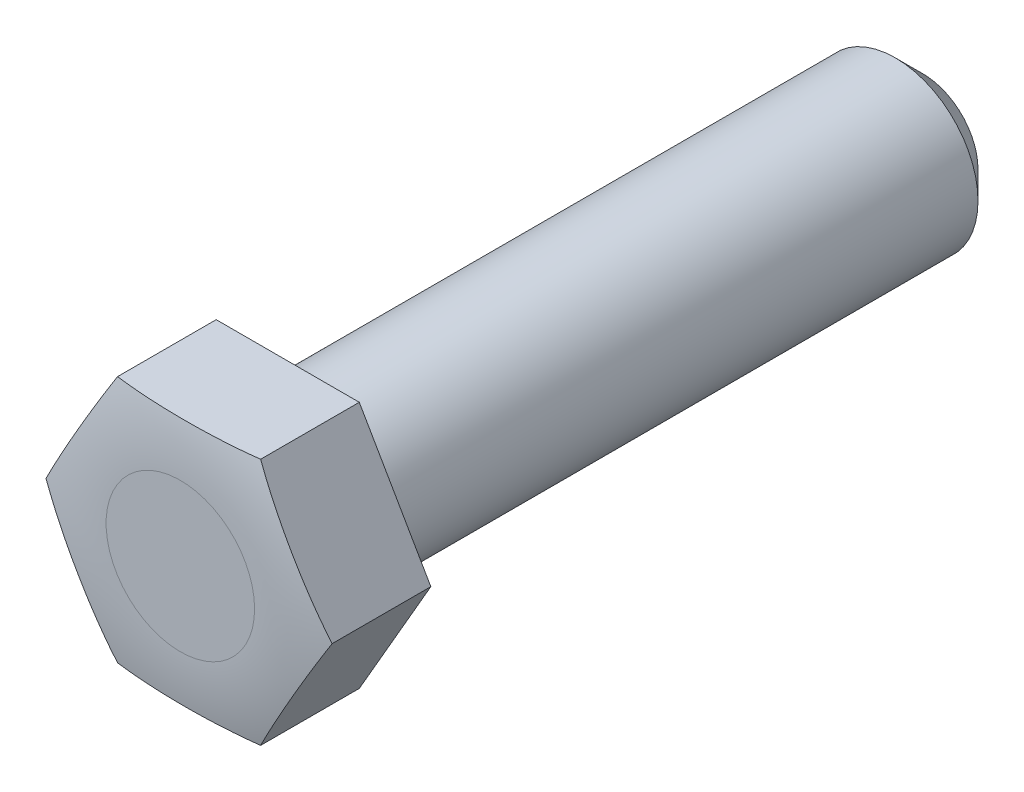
SolidWorks part; units mm, degrees
ref_plane "Plan de face" through (0, 0, 0) normal (0, 0, 1) x (1, 0, 0)
ref_plane "Plan de dessus" through (0, 0, 0) normal (0, 1, 0) x (1, 0, 0)
ref_plane "Plan de droite" through (0, 0, 0) normal (1, 0, 0) x (0, 0, -1)
sketch "Esquisse1" plane through (0, 0, 0) normal (0, 0, 1) x (1, 0, 0)
  circle A0 centre (-67, 70) radius 6
  dimension "D1" = 12
extrude "Extrusion1" add sketch "Esquisse1" against normal blind 28.2321 and the other way blind 25.7
sketch "Esquisse2" plane through (0, 0, 25.7) normal (0, 0, 1) x (1, 0, 0)
  line L1 (-56.6077, 70) -> (-61.8038, 79)
  line L2 (-61.8038, 79) -> (-72.1962, 79)
  line L3 (-72.1962, 79) -> (-77.3923, 70)
  line L4 (-77.3923, 70) -> (-72.1962, 61)
  line L5 (-72.1962, 61) -> (-61.8038, 61)
  line L6 (-61.8038, 61) -> (-56.6077, 70)
  circle A0 centre (-67, 70) radius 9 construction
  dimension "D1" = 18
extrude "Extrusion2" add sketch "Esquisse2" against normal blind 7.8
ref_plane "Plan4" through (-19.9391, -11.5119, 0) normal (-0.866, -0.5, 0) x (0, 0, -1)
sketch "Esquisse3" plane through (-19.9391, -11.5119, 0) normal (-0.866, -0.5, 0) x (0, 0, -1)
  line L0 (-17.9, -94.1218) -> (-6.7394, -94.1218) construction
  line L3 (-25.7, -88.7295) -> (-34.5241, -88.7295)
  line L4 (-25.7, -83.7295) -> (-25.0649, -83.7295)
  line L5 (-34.5241, -88.7295) -> (-34.5241, -83.7295)
  line L6 (-34.5241, -83.7295) -> (-25.7, -83.7295)
  line L9 (-25.7, -99.3179) -> (-25.7, -88.9256) construction
  line L11 (-17.9, -100.1218) -> (-17.9, -88.1218) construction
  arc A0 (-25.7, -88.7295) -> (-25.0649, -83.7295) centre (-5.7, -88.7295) cw
  dimension "D1" = 20
  dimension "D2" = 5
revolve "Enlèvement de matière-Révolution5" cut sketch "Esquisse3" angle 360 about L0
chamfer "Chanfrein1" distance 2 angle 45 1 edges at (-61, 70, -28.2321)
